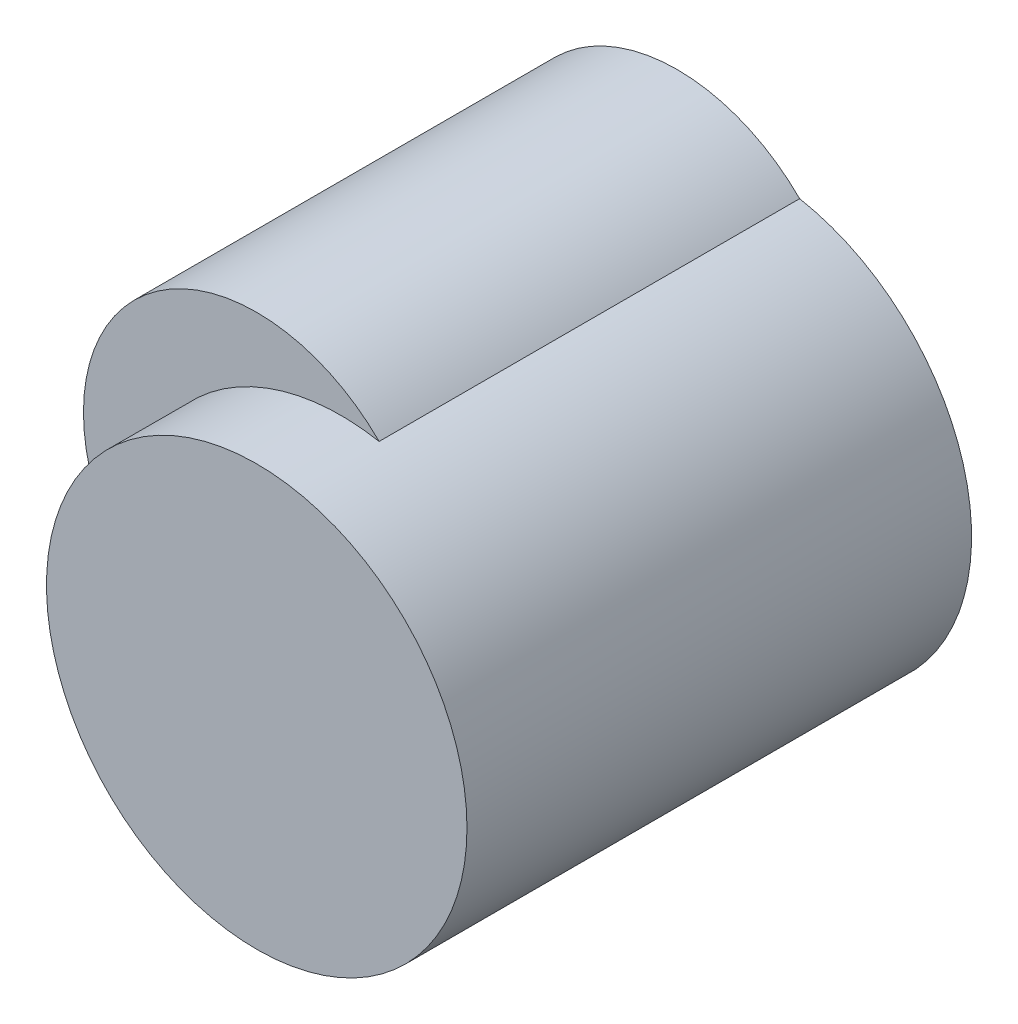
SolidWorks part; units mm, degrees
ref_plane "前视基准面" through (0, 0, 0) normal (0, 0, 1) x (1, 0, 0)
ref_plane "上视基准面" through (0, 0, 0) normal (0, 1, 0) x (1, 0, 0)
ref_plane "右视基准面" through (0, 0, 0) normal (1, 0, 0) x (0, 0, -1)
sketch "草图1" plane through (0, 0, 0) normal (0, 0, 1) x (1, 0, 0)
  line L0 (0, 70.9706) -> (0, -58.6441) construction
  line L1 (-72.2779, 0) -> (55.8426, 0) construction
  circle A0 centre (0, 0) radius 25
  dimension "D1" = 50
extrude "拉伸1" add sketch "草图1" along normal blind 60
sketch "草图2" plane through (0, 0, 0) normal (0, 0, 1) x (1, 0, 0)
  line L0 (-10, 33.8824) -> (-10, -42.8512) construction
  line L1 (-43.2844, 10) -> (6.5426, 10) construction
  line L2 (0, 0) -> (0, 45.2429) construction
  line L3 (-33.5834, 0) -> (27.6042, 0) construction
  circle A0 centre (-10, 10) radius 20.6024
  point P4 (-10, 10)
  point P5 (-10, 10)
  dimension "D1" = 10
  dimension "D2" = 10
extrude "拉伸2" add sketch "草图2" along normal blind 50
